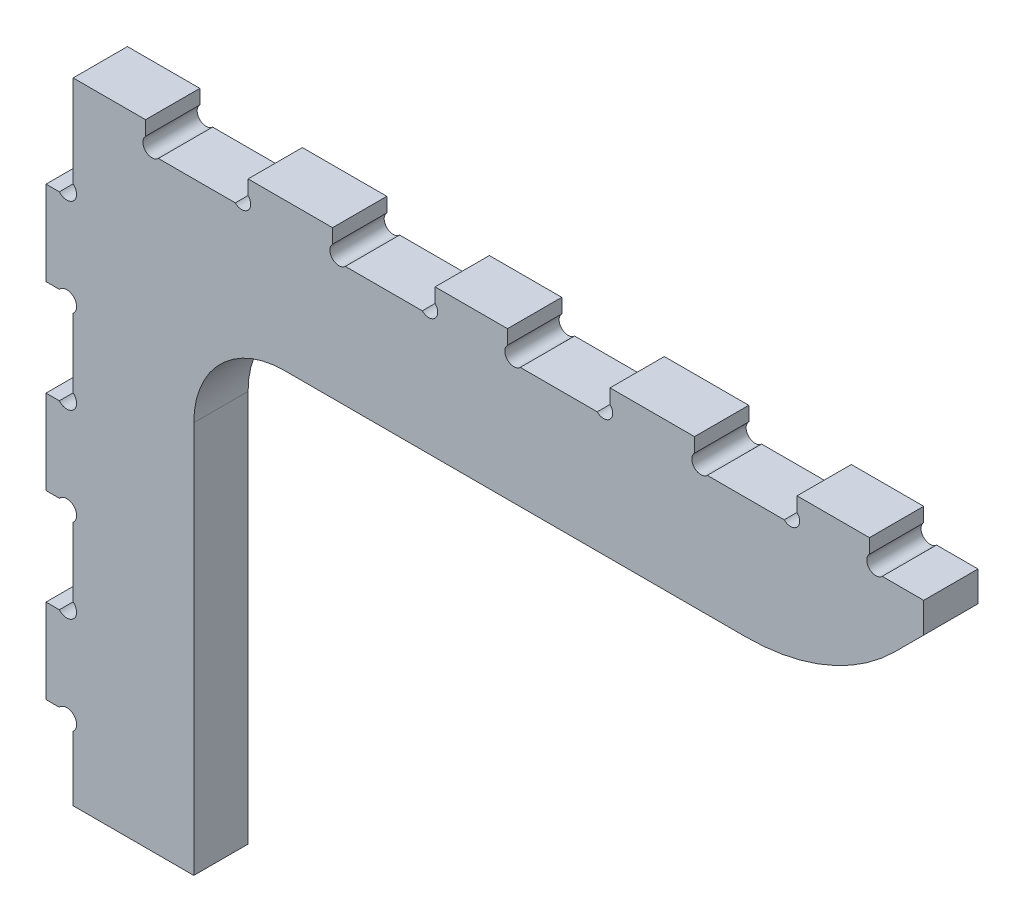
SolidWorks part; units mm, degrees
ref_plane "Plan de face" through (0, 0, 0) normal (0, 0, 1) x (1, 0, 0)
ref_plane "Plan de dessus" through (0, 0, 0) normal (0, 1, 0) x (1, 0, 0)
ref_plane "Plan de droite" through (0, 0, 0) normal (1, 0, 0) x (0, 0, -1)
sketch "Esquisse3" plane through (0, 0, 0) normal (0, 0, 1) x (1, 0, 0)
  line L0 (0, 0) -> (0, 21.4181)
  line L2 (282, 200) -> (282, 160)
  line L3 (282, 160) -> (70, 160)
  line L4 (40, 130) -> (40, 0)
  line L5 (40, 0) -> (0, 0)
  line L6 (0, 0) -> (0, 21.4181) construction
  line L8 (-4.5819, 26) -> (-9, 26)
  line L10 (-4.5819, 54) -> (-9, 54)
  line L11 (-9, 26) -> (-9, 54)
  line L12 (-4.5819, 86) -> (-9, 86)
  line L13 (-9, 86) -> (-9, 114)
  line L14 (-4.5819, 114) -> (-9, 114)
  line L16 (-4.5819, 146) -> (-9, 146)
  line L17 (-9, 146) -> (-9, 174)
  line L18 (-4.5819, 174) -> (-9, 174)
  line L46 (0, 178.5819) -> (0, 200)
  line L49 (0, 118.5819) -> (0, 141.4181)
  line L50 (0, 58.5819) -> (0, 81.4181)
  line L53 (0, 200) -> (0, 209)
  line L54 (0, 209) -> (24, 209)
  line L55 (24, 209) -> (24, 204.2426)
  line L58 (26.1213, 202.1213) -> (24, 202.1213) construction
  line L59 (26.1213, 202.1213) -> (26.1213, 200) construction
  line L60 (28.2426, 200) -> (282, 200)
  arc A1 (70, 160) -> (40, 130) centre (70, 130) ccw
  arc A2 (0, 21.4181) -> (-4.5819, 26) centre (-2.11, 23.89) ccw
  arc A3 (-4.5819, 54) -> (0, 58.5819) centre (-2.11, 56.11) ccw
  arc A4 (0, 81.4181) -> (-4.5819, 86) centre (-2.11, 83.89) ccw
  arc A5 (0, 141.4181) -> (-4.5819, 146) centre (-2.11, 143.89) ccw
  arc A6 (-4.5819, 114) -> (0, 118.5819) centre (-2.11, 116.11) ccw
  arc A7 (-4.5819, 174) -> (0, 178.5819) centre (-2.11, 176.11) ccw
  arc A8 (24, 204.2426) -> (28.2426, 200) centre (26.1213, 202.1213) ccw
  dimension "D4" = 282
  dimension "D8" = 30
  dimension "D12" = 6.5
  dimension "D5" = 6.5
  dimension "D14" = 6
  dimension "D1" = 200
  dimension "D2" = 40
  dimension "D3" = 40
  dimension "D6" = 28
  dimension "D9" = 2.11
  dimension "D10" = 9
  dimension "D11" = 24
  dimension "D15" = 2.11
  dimension "D16" = 2.11
  dimension "D17" = 2.11
  dimension "D18" = 9
  dimension "D29" = 26
  dimension "D7" = 3
  dimension "D19" = 3
  dimension "D20" = 3
extrude "Boss.-Extru.1" add sketch "Esquisse3" along normal blind 18
chamfer "Chanfrein1" distance 30 angle 45 1 edges at (282, 160, 9)
fillet "Congé3" radius 70 1 edges at (252, 160, 9)
sketch "Esquisse4" plane through (0, 200, 0) normal (0, 1, 0) x (1, 0, 0)
  line L0 (58, 0) -> (58, -18) construction
  line L1 (282, 0) -> (28.2426, 0) construction
  line L2 (282, -18) -> (28.2426, -18) construction
  line L3 (24, -18) -> (24, 0) construction
  line L5 (58, 0) -> (86, 0)
  line L6 (58, 0) -> (58, -18)
  line L7 (58, -18) -> (86, -18)
  line L8 (86, 0) -> (86, -18)
  dimension "D1" = 34
  dimension "D2" = 28
extrude "Boss.-Extru.2" add sketch "Esquisse4" along normal blind 9
sketch "Esquisse5" plane through (0, 0, 18) normal (0, 0, 1) x (1, 0, 0)
  line L0 (55.8787, 202.1213) -> (55.8787, 200) construction
  line L1 (58, 200) -> (28.2426, 200) construction
  line L2 (55.8787, 202.1213) -> (58, 202.1213) construction
  line L3 (58, 209) -> (58, 200) construction
  circle A0 centre (55.8787, 202.1213) radius 3
  dimension "D1" = 6
extrude "Enlèv. mat.-Extru.4" cut sketch "Esquisse5" against normal through all
sketch "Esquisse6" plane through (0, 0, 18) normal (0, 0, 1) x (1, 0, 0)
  line L0 (88.1213, 202.1213) -> (86, 202.1213) construction
  line L1 (86, 209) -> (86, 200) construction
  line L2 (88.1213, 202.1213) -> (88.1213, 200) construction
  line L3 (282, 200) -> (86, 200) construction
  circle A0 centre (88.1213, 202.1213) radius 3
  dimension "D1" = 6
extrude "Enlèv. mat.-Extru.5" cut sketch "Esquisse6" against normal through all
sketch "Esquisse7" plane through (0, 200, 0) normal (0, 1, 0) x (1, 0, 0)
  line L0 (282, 0) -> (90.2426, 0) construction
  line L1 (120, 0) -> (144, 0)
  line L2 (120, 0) -> (120, -18)
  line L3 (120, -18) -> (144, -18)
  line L4 (144, 0) -> (144, -18)
  line L5 (282, -18) -> (90.2426, -18) construction
  line L6 (86, -18) -> (86, 0) construction
  line L8 (178, 0) -> (206, 0)
  line L9 (178, 0) -> (178, -18)
  line L10 (178, -18) -> (206, -18)
  line L11 (206, 0) -> (206, -18)
  line L12 (240, 0) -> (264, 0)
  line L13 (240, 0) -> (240, -18)
  line L14 (240, -18) -> (264, -18)
  line L15 (264, 0) -> (264, -18)
  dimension "D1" = 34
  dimension "D2" = 24
  dimension "D3" = 34
  dimension "D4" = 28
  dimension "D5" = 34
  dimension "D6" = 24
extrude "Boss.-Extru.3" add sketch "Esquisse7" along normal blind 9
pattern_linear "Répétition linéaire1" count 4 spacing 62 along (1, 0, 0) of "Enlèv. mat.-Extru.4"
pattern_linear "Répétition linéaire2" count 4 spacing 60 along (1, 0, 0) of "Enlèv. mat.-Extru.5"
